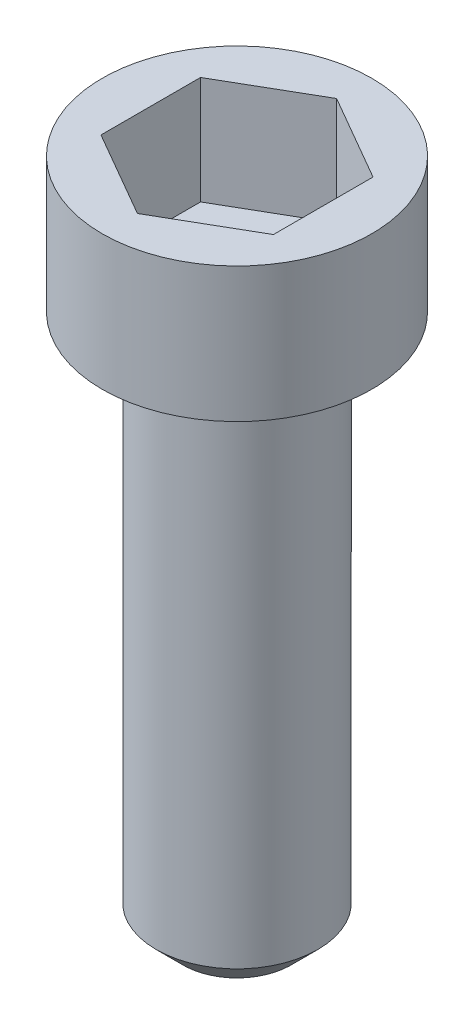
SolidWorks part; units mm, degrees
ref_plane "Plan de face" through (0, 0, 0) normal (0, 0, 1) x (1, 0, 0)
ref_plane "Plan de dessus" through (0, 0, 0) normal (0, 1, 0) x (1, 0, 0)
ref_plane "Plan de droite" through (0, 0, 0) normal (1, 0, 0) x (0, 0, -1)
sketch "Esquisse1" plane through (0, 0, 0) normal (0, 1, 0) x (1, 0, 0)
  circle A0 centre (0, 0) radius 2.5
  dimension "D1" = 5
extrude "Extrusion1" add sketch "Esquisse1" along normal blind 2.5
sketch "Esquisse2" plane through (0, 2.5, 0) normal (0, 1, 0) x (-1, 0, 0)
  line L1 (0, 1.8475) -> (-1.6, 0.9238)
  line L2 (-1.6, 0.9238) -> (-1.6, -0.9238)
  line L3 (-1.6, -0.9238) -> (0, -1.8475)
  line L4 (0, -1.8475) -> (1.6, -0.9238)
  line L5 (1.6, -0.9238) -> (1.6, 0.9238)
  line L6 (1.6, 0.9238) -> (0, 1.8475)
  circle A0 centre (0, 0) radius 1.6 construction
  dimension "D1" = 3.2
extrude "Enlèv. mat.-Extru.1" cut sketch "Esquisse2" against normal blind 2
sketch "Esquisse3" plane through (0, 0, 0) normal (0, -1, 0) x (1, 0, 0)
  circle A0 centre (0, 0) radius 1.5
extrude "Extrusion2" add sketch "Esquisse3" along normal blind 10
chamfer "Chanfrein1" distance 0.5 angle 45 1 edges at (0, -10, -1.5)
